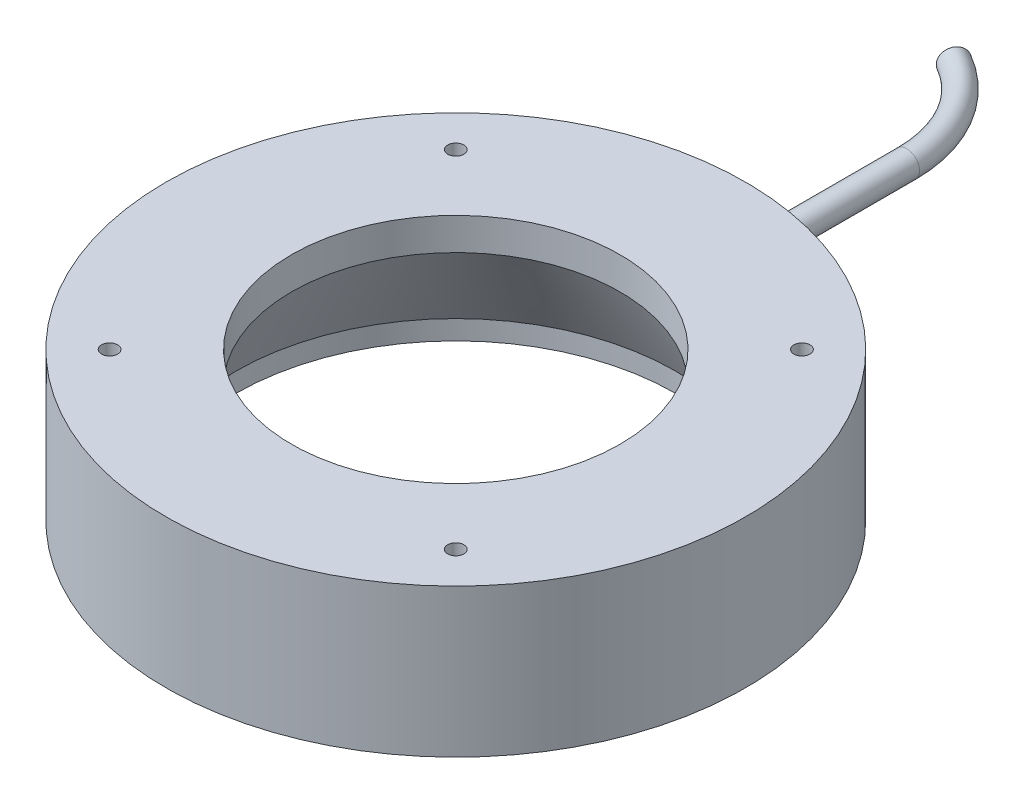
SolidWorks part; units mm, degrees
ref_plane "Front Plane" through (0, 0, 0) normal (0, 0, 1) x (1, 0, 0)
ref_plane "Top Plane" through (0, 0, 0) normal (0, 1, 0) x (1, 0, 0)
ref_plane "Right Plane" through (0, 0, 0) normal (1, 0, 0) x (0, 0, -1)
sketch "Sketch1" plane through (0, 0, 0) normal (0, 0, 1) x (1, 0, 0)
  line L0 (0, 0) -> (0, -23) construction
  line L1 (-25.5, 0) -> (-45, 0)
  line L2 (-45, 0) -> (-45, -23)
  line L3 (-45, -23) -> (-34.1603, -23)
  line L4 (-34.1603, -23) -> (-34.1603, -20)
  line L5 (-34.1603, -20) -> (-25.5, -5)
  line L6 (-25.5, -5) -> (-25.5, 0)
  line L7 (0, -12.65) -> (0, 12.65) construction
  line L8 (49.5, 0) -> (-49.5, 0) construction
  dimension "D1" = 51
  dimension "D2" = 30
  dimension "D3" = 3
  dimension "D4" = 90
  dimension "D5" = 23
  dimension "D6" = 5
revolve "Revolve1" add sketch "Sketch1" angle 360 about L0
hole_wizard "M3 Tapped Hole1" positions "Sketch3" profile "Sketch2" tap size "M3" standard "Iso"
sketch "Sketch3" plane through (0, 0, 0) normal (0, 1, 0) x (1, 0, 0)
  line L1 (0, 0) -> (-26.8701, 0) construction
  line L2 (0, 0) -> (0, 26.8701) construction
  line L3 (0, 26.8701) -> (-26.8701, 26.8701) construction
  line L4 (-26.8701, 0) -> (-26.8701, 26.8701) construction
  line L5 (-26.8701, 0) -> (-26.8701, -26.8701) construction
  line L6 (-26.8701, -26.8701) -> (26.8701, -26.8701) construction
  line L7 (26.8701, -26.8701) -> (26.8701, 26.8701) construction
  line L8 (26.8701, 26.8701) -> (0, 26.8701) construction
  circle A0 centre (0, 0) radius 38 construction
  point P0 (-26.8701, 26.8701)
  point P2 (-26.8701, -26.8701)
  point P4 (26.8701, -26.8701)
  point P6 (26.8701, 26.8701)
  dimension "D1" = 76
sketch "Sketch2" plane through (-26.8701, 0, -26.8701) normal (1, 0, 0) x (0, 0, 1)
  line L0 (0, 0) -> (0, 9.2511)
  line L1 (0, 9.2511) -> (1.25, 8.5)
  line L2 (1.25, 8.5) -> (1.25, 0)
  line L5 (1.25, 0) -> (0, 0)
  line L10 (0, 9.2511) -> (-1.25, 8.5) construction
  line L11 (0, -6.35) -> (0, 107.95) construction
  dimension "ねじ下穴ﾄﾞﾘﾙ直径" = 2.5
  dimension "ねじ下穴ﾄﾞﾘﾙの深さ" = 8.5
  dimension "ﾄﾞﾘﾙ角度" = 118
sketch "Sketch4" plane through (0, 0, 0) normal (0, 0, 1) x (1, 0, 0)
  line L0 (0, -12.65) -> (0, 12.65) construction
  line L1 (49.5, 0) -> (-49.5, 0) construction
  circle A0 centre (0, -10) radius 2
  dimension "D2" = 4
  dimension "D1" = 10
extrude "Extrude1" add sketch "Sketch4" along normal up to next from offset 70
ref_plane "Plane1" through (0, -10, 0) normal (0, 1, 0) x (1, 0, 0)
sketch "Sketch5" plane through (0, 0, -70) normal (0, 0, -1) x (-1, 0, 0)
  circle A0 centre (0, -10) radius 2 construction
  circle A1 centre (0, -10) radius 2
sketch "Sketch6" plane through (0, -10, 0) normal (0, 1, 0) x (1, 0, 0)
  arc A0 (0, 70) -> (-10, 87.3205) centre (-20, 70) ccw
  dimension "D1" = 20
  dimension "D2" = 20
sweep "Sweep1" add profiles "Sketch5" path "Sketch6"
